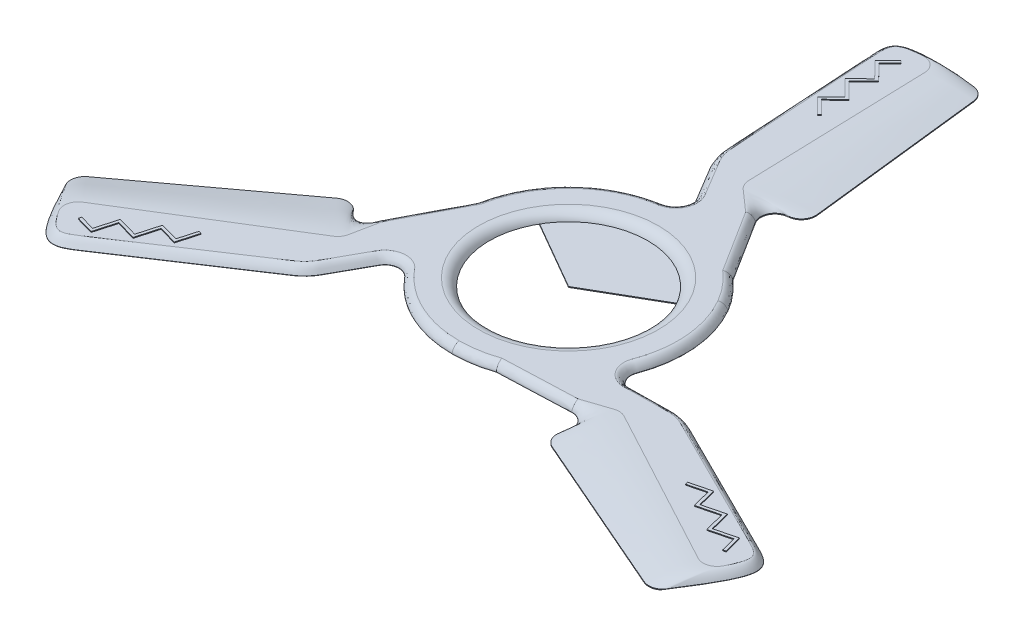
SolidWorks part; units mm, degrees
ref_plane "Front Plane" through (0, 0, 0) normal (0, 0, 1) x (1, 0, 0)
ref_plane "Top Plane" through (0, 0, 0) normal (0, 1, 0) x (1, 0, 0)
ref_plane "Right Plane" through (0, 0, 0) normal (1, 0, 0) x (0, 0, -1)
sketch "Sketch1" plane through (0, 0, 0) normal (0, 1, 0) x (1, 0, 0)
  line L0 (0, 133.3333) -> (-115.4701, -66.6667) construction
  line L1 (-115.4701, -66.6667) -> (115.4701, -66.6667) construction
  line L2 (115.4701, -66.6667) -> (0, 133.3333) construction
  line L3 (0, 133.3333) -> (0, 0) construction
  line L4 (14.8113, 128.356) -> (21.9143, 65.9427)
  line L5 (17.6439, 60.4262) -> (16.8663, 60.3167)
  line L6 (13.3352, 52.6977) -> (26.9924, 31.0503)
  line L7 (58.3991, -20.9341) -> (43.294, -21.1771)
  line L8 (-11.0701, 61.0421) -> (-3.3071, 48.0823)
  line L9 (-16.5142, 122.1729) -> (-13.1737, 67.8298)
  line L10 (114.062, -46.7847) -> (65.3292, -22.5061)
  line L11 (103.7539, -77.005) -> (46.1509, -51.9497)
  line L12 (43.5087, -45.4932) -> (43.8026, -44.765)
  line L13 (38.9699, -37.8974) -> (13.3942, -38.9012)
  line L14 (-47.329, -40.108) -> (-39.9869, -26.9052)
  line L15 (-97.5477, -75.3882) -> (-52.1554, -45.3237)
  line L16 (-118.5653, -51.351) -> (-68.0652, -13.993)
  line L17 (-61.1526, -14.933) -> (-60.6689, -15.5517)
  line L18 (-52.3051, -14.8003) -> (-40.3865, 7.8509)
  line L19 (-118.3722, -51.2083) -> (-71.4773, -16.5172)
  line L20 (-63.96, -11.3423) -> (-54.6343, -23.2701)
  line L21 (-56.1731, -22.1514) -> (-42.7971, 3.2696)
  line L22 (-53.1056, -50.4957) -> (-38.0894, -23.4931)
  line L23 (-96.7038, -74.8293) -> (-51.4545, -44.8594)
  line L24 (70.2834, -20.743) -> (39.3903, -21.2399)
  line L25 (113.156, -46.3334) -> (64.5766, -22.1312)
  line L26 (41.8027, -49.7198) -> (47.4696, -35.6796)
  line L27 (103.5338, -76.9092) -> (50.043, -53.6426)
  line L28 (47.2702, -37.5717) -> (18.567, -38.6982)
  line L29 (0, 0) -> (51.9615, 30) construction
  line L30 (0, 0) -> (-171.6742, 99.1162) construction
  circle A0 centre (0, 0) radius 133.3333 construction
  circle A1 centre (0, 0) radius 21.1426
  arc A2 (-6.7733, 40.5812) -> (-40.3865, 7.8509) centre (0, 0) ccw
  arc A4 (14.8113, 128.356) -> (10.0917, 132.7845) centre (9.8434, 127.7907) ccw
  arc A5 (65.3292, -22.5061) -> (58.3991, -20.9341) centre (58.6403, -35.9322) ccw
  arc A6 (103.7539, -77.005) -> (109.9489, -75.132) centre (105.7483, -72.42) ccw
  arc A7 (-13.1737, 67.8298) -> (-11.0701, 61.0421) centre (1.798, 68.7501) ccw
  arc A8 (21.9143, 65.9427) -> (17.6439, 60.4262) centre (16.9463, 65.3773) cw
  arc A9 (16.8663, 60.3167) -> (13.3352, 52.6977) centre (17.5639, 55.3656) ccw
  arc A10 (-118.5653, -51.351) -> (-120.0406, -57.6525) centre (-115.5917, -55.3707) ccw
  arc A11 (103.7539, -77.005) -> (109.9489, -75.132) centre (105.7483, -72.42) ccw
  arc A12 (46.1509, -51.9497) -> (43.5087, -45.4932) centre (48.1453, -47.3646) cw
  arc A13 (43.8026, -44.765) -> (38.9699, -37.8974) centre (39.166, -42.8936) ccw
  arc A14 (-52.1554, -45.3237) -> (-47.329, -40.108) centre (-60.4383, -32.8179) ccw
  arc A15 (-118.5653, -51.351) -> (-120.0406, -57.6525) centre (-115.5917, -55.3707) ccw
  arc A16 (-68.0652, -13.993) -> (-61.1526, -14.933) centre (-65.0916, -18.0127) cw
  arc A17 (-60.6689, -15.5517) -> (-52.3051, -14.8003) centre (-56.7299, -12.472) ccw
  circle A18 centre (0, 0) radius 41.1426 construction
  arc A19 (-31.7577, -26.1565) -> (13.3942, -38.9012) centre (0, 0) ccw
  arc A20 (38.531, -14.4247) -> (26.9924, 31.0503) centre (0, 0) ccw
  arc A21 (43.294, -21.1771) -> (38.531, -14.4247) centre (43.2136, -16.1777) cw
  arc A22 (-39.9869, -26.9052) -> (-31.7577, -26.1565) centre (-35.6171, -29.3352) cw
  arc A23 (-3.3071, 48.0823) -> (-6.7733, 40.5812) centre (-7.5965, 45.513) cw
  spline S0 degree 3 poles (10.0917, 132.7845) (-2.5557, 133.4135) (-16.6916, 133.1425) (-16.756, 126.1067) (-16.5142, 122.1729) knots 0.057289 0.057289 0.057289 0.057289 0.528644 1 1 1 1
  spline S1 degree 3 poles (109.9489, -75.132) (116.8173, -64.4934) (123.7868, -51.8838) (117.3172, -49.0066) (114.062, -46.7847) knots 0.057289 0.057289 0.057289 0.057289 0.528644 1 1 1 1
  spline S2 degree 3 poles (-120.0406, -57.6525) (-114.2616, -68.9201) (-106.8261, -81.2606) (-101.0995, -77.0964) (-97.5477, -75.3882) knots 0.057289 0.057289 0.057289 0.057289 0.528644 1 1 1 1
  point P43 (0, 0)
  point P87 (0, 0)
  dimension "D3" = 5
  dimension "D5" = 15
  dimension "D6" = 5
  dimension "D8" = 5
  dimension "D1" = 200
  dimension "D9" = 120
  dimension "D10" = 60
  dimension "D2" = 20
  dimension "D4" = 3
  dimension "D7" = 3
sketch "Sketch2" plane through (0, 0, 0) normal (0, 1, 0) x (1, 0, 0)
  line L30 (0.1519, 125.6874) -> (2.1157, 61.5073)
  line L31 (3.8041, 57.9121) -> (11.2208, 51.3637)
  line L32 (108.7753, -62.9767) -> (52.2091, -32.5859)
  line L33 (48.2513, -32.2505) -> (38.8719, -35.3993)
  line L34 (-108.9271, -62.7138) -> (-54.3247, -28.9214)
  line L35 (-52.0554, -25.6616) -> (-50.0927, -15.9644)
  line L45 (-14.0189, 122.3263) -> (-10.6784, 67.9832)
  line L46 (-8.9254, 62.3268) -> (-1.1624, 49.3669)
  line L47 (-38, 7.0178) -> (-50.0927, -15.9644)
  line L48 (-62.6384, -17.0915) -> (-63.1221, -16.4729)
  line L49 (-66.5784, -16.0029) -> (-117.0785, -53.3609)
  line L50 (-98.7878, -73.2109) -> (-53.5359, -43.2394)
  line L51 (-49.5139, -38.893) -> (-42.1718, -25.6902)
  line L52 (12.9224, -36.4178) -> (38.8719, -35.3993)
  line L53 (46.1209, -45.7007) -> (45.827, -46.4289)
  line L54 (47.1481, -49.6571) -> (104.7511, -74.7125)
  line L55 (112.7964, -48.9473) -> (64.2144, -24.7438)
  line L56 (58.4393, -23.4338) -> (43.3342, -23.6768)
  line L57 (25.0776, 29.4) -> (11.2208, 51.3637)
  line L58 (16.5175, 62.7922) -> (17.2951, 62.9018)
  line L59 (19.4303, 65.66) -> (12.3274, 128.0734)
  line L60 (-14.0189, 122.3263) -> (-10.6784, 67.9832)
  line L61 (-8.9254, 62.3268) -> (-1.1624, 49.3669)
  line L62 (-38, 7.0178) -> (-50.0927, -15.9644)
  line L65 (-98.7878, -73.2109) -> (-53.5359, -43.2394)
  line L66 (-49.5139, -38.893) -> (-42.1718, -25.6902)
  line L67 (12.9224, -36.4178) -> (38.8719, -35.3993)
  line L70 (112.7964, -48.9473) -> (64.2144, -24.7438)
  line L71 (58.4393, -23.4338) -> (43.3342, -23.6768)
  line L72 (25.0776, 29.4) -> (11.2208, 51.3637)
  arc A36 (2.1157, 61.5073) -> (3.8041, 57.9121) centre (7.1134, 61.6602) ccw
  arc A37 (52.2091, -32.5859) -> (48.2513, -32.2505) centre (49.8427, -36.9905) ccw
  arc A38 (-54.3247, -28.9214) -> (-52.0554, -25.6616) centre (-56.956, -24.6698) ccw
  arc A39 (-108.9271, -62.7138) -> (-110.49, -69.6873) centre (-106.2958, -66.9654) ccw
  arc A40 (108.7753, -62.9767) -> (115.596, -60.8435) centre (111.1417, -58.5722) ccw
  arc A41 (0.1519, 125.6874) -> (-5.1125, 130.5274) centre (-4.8458, 125.5345) ccw
  arc A54 (-10.6784, 67.9832) -> (-8.9254, 62.3268) centre (1.798, 68.7501) ccw
  arc A55 (-6.3618, 38.1153) -> (-1.1624, 49.3669) centre (-7.5965, 45.513) ccw
  arc A56 (-6.3618, 38.1153) -> (-38, 7.0178) centre (0, 0) ccw
  arc A57 (-62.6384, -17.0915) -> (-50.0927, -15.9644) centre (-56.7299, -12.472) ccw
  arc A58 (-63.1221, -16.4729) -> (-66.5784, -16.0029) centre (-65.0916, -18.0127) ccw
  arc A59 (-117.0785, -53.3609) -> (-117.8161, -56.5116) centre (-115.5917, -55.3707) ccw
  arc A60 (-53.5359, -43.2394) -> (-49.5139, -38.893) centre (-60.4383, -32.8179) ccw
  arc A61 (-29.8279, -24.5671) -> (-42.1718, -25.6902) centre (-35.6171, -29.3352) ccw
  arc A62 (-29.8279, -24.5671) -> (12.9224, -36.4178) centre (0, 0) ccw
  arc A63 (46.1209, -45.7007) -> (38.8719, -35.3993) centre (39.166, -42.8936) ccw
  arc A64 (45.827, -46.4289) -> (47.1481, -49.6571) centre (48.1453, -47.3646) ccw
  arc A65 (104.7511, -74.7125) -> (107.8486, -73.776) centre (105.7483, -72.42) ccw
  arc A66 (64.2144, -24.7438) -> (58.4393, -23.4338) centre (58.6403, -35.9322) ccw
  arc A67 (36.1897, -13.5482) -> (43.3342, -23.6768) centre (43.2136, -16.1777) ccw
  arc A68 (36.1897, -13.5482) -> (25.0776, 29.4) centre (0, 0) ccw
  arc A69 (16.5175, 62.7922) -> (11.2208, 51.3637) centre (17.5639, 55.3656) ccw
  arc A70 (17.2951, 62.9018) -> (19.4303, 65.66) centre (16.9463, 65.3773) ccw
  arc A71 (12.3274, 128.0734) -> (9.9676, 130.2876) centre (9.8434, 127.7907) ccw
  arc A72 (-10.6784, 67.9832) -> (-8.9254, 62.3268) centre (1.798, 68.7501) ccw
  arc A73 (-6.3618, 38.1153) -> (-1.1624, 49.3669) centre (-7.5965, 45.513) ccw
  arc A74 (-6.3618, 38.1153) -> (-38, 7.0178) centre (0, 0) ccw
  arc A78 (-53.5359, -43.2394) -> (-49.5139, -38.893) centre (-60.4383, -32.8179) ccw
  arc A79 (-29.8279, -24.5671) -> (-42.1718, -25.6902) centre (-35.6171, -29.3352) ccw
  arc A80 (-29.8279, -24.5671) -> (12.9224, -36.4178) centre (0, 0) ccw
  arc A84 (64.2144, -24.7438) -> (58.4393, -23.4338) centre (58.6403, -35.9322) ccw
  arc A85 (36.1897, -13.5482) -> (43.3342, -23.6768) centre (43.2136, -16.1777) ccw
  arc A86 (36.1897, -13.5482) -> (25.0776, 29.4) centre (0, 0) ccw
  spline S9 degree 3 poles (-1995.2262, -721.2333) (-142.2395, 160.3019) (-164.5779, 28.9927) (-113.7422, -64.2099) (-113.1359, -65.2966) (-111.8871, -67.4502) (-111.2454, -68.517) (-110.2339, -70.0846) (-109.8884, -70.6016) (-109.1722, -71.6193) (-108.8011, -72.1208) (-108.0211, -73.092) (-107.6113, -73.5643) (-106.9479, -74.2195) (-106.7189, -74.4286) (-106.356, -74.7197) (-106.2318, -74.8129) (-105.9742, -74.9886) (-105.8399, -75.0714) (-105.5641, -75.2181) (-105.4226, -75.2822) (-105.1296, -75.3864) (-104.9764, -75.4265) (-104.5117, -75.5) (-104.2017, -75.4867) (-103.5814, -75.3851) (-103.2834, -75.3005) (-102.6985, -75.1005) (-102.4119, -74.9843) (-101.561, -74.6109) (-101.0057, -74.3301) (-73.2187, -60.1882) (-49.0324, -40.2446) (875.9367, -1818.7216) knots -10.290782 -10.290782 -10.290782 -10.290782 0.25 0.25 0.375 0.375 0.5 0.5 0.5625 0.5625 0.625 0.625 0.6875 0.6875 0.71875 0.71875 0.734375 0.734375 0.75 0.75 0.765625 0.765625 0.78125 0.78125 0.8125 0.8125 0.84375 0.84375 0.875 0.875 0.9375 0.9375 4.012603 4.012603 4.012603 4.012603 only from (-117.8161, -56.5116) to (-98.7878, -73.2109)
  spline S10 degree 3 poles (1622.2194, -1367.3) (-67.7058, -203.334) (57.1805, -157.025) (112.4785, -66.3987) (113.1165, -65.3303) (114.3572, -63.1719) (114.9602, -62.0828) (115.812, -60.4231) (116.087, -59.8653) (116.6103, -58.7362) (116.859, -58.1641) (117.31, -57.003) (117.5142, -56.412) (117.7499, -55.5099) (117.8165, -55.207) (117.8872, -54.7472) (117.9058, -54.593) (117.9291, -54.2821) (117.9337, -54.1243) (117.9228, -53.8122) (117.9076, -53.6575) (117.8513, -53.3517) (117.8095, -53.199) (117.6408, -52.7598) (117.4742, -52.4979) (117.0761, -52.0116) (116.8538, -51.7958) (116.3882, -51.3892) (116.1442, -51.1992) (115.3954, -50.649) (114.8746, -50.3084) (88.7339, -33.3152) (59.369, -22.341) (1137.0907, 1667.9442) knots -10.290782 -10.290782 -10.290782 -10.290782 0.25 0.25 0.375 0.375 0.5 0.5 0.5625 0.5625 0.625 0.625 0.6875 0.6875 0.71875 0.71875 0.734375 0.734375 0.75 0.75 0.765625 0.765625 0.78125 0.78125 0.8125 0.8125 0.84375 0.84375 0.875 0.875 0.9375 0.9375 4.012603 4.012603 4.012603 4.012603 only from (107.8486, -73.776) to (112.7964, -48.9473)
  spline S11 degree 3 poles (370.7154, 2089.1164) (208.5289, 43.7019) (106.6812, 128.0468) (1.273, 130.6086) (0.0302, 130.6269) (-2.4567, 130.6216) (-3.7001, 130.5988) (-5.5612, 130.5051) (-6.1811, 130.4637) (-7.419, 130.3508) (-8.0382, 130.2793) (-9.2675, 130.0878) (-9.8801, 129.9684) (-10.7796, 129.723) (-11.0753, 129.6303) (-11.654, 129.4115) (-11.9372, 129.2859) (-12.4816, 128.9766) (-12.7373, 128.7953) (-13.0722, 128.4709) (-13.177, 128.3525) (-13.3647, 128.1011) (-13.447, 127.9693) (-13.6644, 127.5583) (-13.7711, 127.2602) (-13.929, 126.6583) (-13.9815, 126.3537) (-14.0931, 125.4337) (-14.107, 124.8105) (-13.6734, 93.7167) (44.2859, 65.0814) (-2007.3807, -30.9112) knots -10.229273 -10.229273 -10.229273 -10.229273 0.25 0.25 0.375 0.375 0.5 0.5 0.5625 0.5625 0.625 0.625 0.6875 0.6875 0.71875 0.71875 0.75 0.75 0.78125 0.78125 0.796875 0.796875 0.8125 0.8125 0.84375 0.84375 0.875 0.875 0.9375 0.9375 4.002014 4.002014 4.002014 4.002014 only from (9.9676, 130.2876) to (-14.0189, 122.3263)
  spline S12 degree 3 poles (-110.49, -69.6873) (-110.1786, -70.1672) (-109.8598, -70.6423) (-109.1722, -71.6193) (-108.8011, -72.1208) (-108.0211, -73.092) (-107.6113, -73.5643) (-106.9479, -74.2195) (-106.7189, -74.4286) (-106.356, -74.7197) (-106.2318, -74.8129) (-105.9742, -74.9886) (-105.8399, -75.0714) (-105.5641, -75.2181) (-105.4226, -75.2822) (-105.1296, -75.3864) (-104.9764, -75.4265) (-104.5117, -75.5) (-104.2017, -75.4867) (-103.5814, -75.3851) (-103.2834, -75.3005) (-102.6985, -75.1005) (-102.4119, -74.9843) (-101.561, -74.6109) (-101.0057, -74.3301) (-99.8986, -73.7667) (-99.3464, -73.4825) (-98.7878, -73.2109) knots 0.505 0.505 0.505 0.505 0.5625 0.5625 0.625 0.625 0.6875 0.6875 0.71875 0.71875 0.734375 0.734375 0.75 0.75 0.765625 0.765625 0.78125 0.78125 0.8125 0.8125 0.84375 0.84375 0.875 0.875 0.9375 0.9375 1 1 1 1
  spline S13 degree 3 poles (115.596, -60.8435) (115.8559, -60.3338) (116.1079, -59.8202) (116.6103, -58.7362) (116.859, -58.1641) (117.31, -57.003) (117.5142, -56.412) (117.7499, -55.5099) (117.8165, -55.207) (117.8872, -54.7472) (117.9058, -54.593) (117.9291, -54.2821) (117.9337, -54.1243) (117.9228, -53.8122) (117.9076, -53.6575) (117.8513, -53.3517) (117.8095, -53.199) (117.6408, -52.7598) (117.4742, -52.4979) (117.0761, -52.0116) (116.8538, -51.7958) (116.3882, -51.3892) (116.1442, -51.1992) (115.3954, -50.649) (114.8746, -50.3084) (113.8332, -49.6314) (113.3109, -49.2953) (112.7964, -48.9473) knots 0.505 0.505 0.505 0.505 0.5625 0.5625 0.625 0.625 0.6875 0.6875 0.71875 0.71875 0.734375 0.734375 0.75 0.75 0.765625 0.765625 0.78125 0.78125 0.8125 0.8125 0.84375 0.84375 0.875 0.875 0.9375 0.9375 1 1 1 1
  spline S14 degree 3 poles (-5.1125, 130.5274) (-5.6756, 130.4973) (-6.2382, 130.4585) (-7.419, 130.3508) (-8.0382, 130.2793) (-9.2675, 130.0878) (-9.8801, 129.9684) (-10.7796, 129.723) (-11.0753, 129.6303) (-11.654, 129.4115) (-11.9372, 129.2859) (-12.4816, 128.9766) (-12.7373, 128.7953) (-13.0722, 128.4709) (-13.177, 128.3525) (-13.3647, 128.1011) (-13.447, 127.9693) (-13.6644, 127.5583) (-13.7711, 127.2602) (-13.929, 126.6583) (-13.9815, 126.3537) (-14.0931, 125.4337) (-14.107, 124.8105) (-14.0897, 123.5675) (-14.0571, 122.9468) (-14.0189, 122.3263) knots 0.505765 0.505765 0.505765 0.505765 0.5625 0.5625 0.625 0.625 0.6875 0.6875 0.71875 0.71875 0.75 0.75 0.78125 0.78125 0.796875 0.796875 0.8125 0.8125 0.84375 0.84375 0.875 0.875 0.9375 0.9375 1 1 1 1
  point P12 (0, 0)
  dimension "D3" = 5
  dimension "D1" = 2.5
  dimension "D2" = 3
ref_plane "Plane1" through (0, 3, 0) normal (0, 1, 0) x (1, 0, 0)
sketch "Sketch3" plane through (0, 3, 0) normal (0, 1, 0) x (1, 0, 0)
  line L0 (-14.0189, 122.3263) -> (-10.6784, 67.9832) construction
  line L1 (-8.9254, 62.3268) -> (-1.1624, 49.3669) construction
  line L2 (-38, 7.0178) -> (-50.0927, -15.9644) construction
  line L3 (-52.0554, -25.6616) -> (-50.0927, -15.9644) construction
  line L4 (-108.9271, -62.7138) -> (-54.3247, -28.9214) construction
  line L5 (-98.7878, -73.2109) -> (-53.5359, -43.2394) construction
  line L6 (-49.5139, -38.893) -> (-42.1718, -25.6902) construction
  line L7 (12.9224, -36.4178) -> (38.8719, -35.3993) construction
  line L8 (48.2513, -32.2505) -> (38.8719, -35.3993) construction
  line L9 (108.7753, -62.9767) -> (52.2091, -32.5859) construction
  line L10 (112.7964, -48.9473) -> (64.2144, -24.7438) construction
  line L11 (58.4393, -23.4338) -> (43.3342, -23.6768) construction
  line L12 (25.0776, 29.4) -> (11.2208, 51.3637) construction
  line L13 (3.8041, 57.9121) -> (11.2208, 51.3637) construction
  line L14 (0.1519, 125.6874) -> (2.1157, 61.5073) construction
  line L15 (-14.0189, 122.3263) -> (-10.6784, 67.9832)
  line L16 (-8.9254, 62.3268) -> (-1.1624, 49.3669)
  line L17 (-38, 7.0178) -> (-50.0927, -15.9644)
  line L18 (-52.0554, -25.6616) -> (-50.0927, -15.9644)
  line L19 (-108.9271, -62.7138) -> (-54.3247, -28.9214)
  line L20 (-98.7878, -73.2109) -> (-53.5359, -43.2394)
  line L21 (-49.5139, -38.893) -> (-42.1718, -25.6902)
  line L22 (12.9224, -36.4178) -> (38.8719, -35.3993)
  line L23 (48.2513, -32.2505) -> (38.8719, -35.3993)
  line L24 (108.7753, -62.9767) -> (52.2091, -32.5859)
  line L25 (112.7964, -48.9473) -> (64.2144, -24.7438)
  line L26 (58.4393, -23.4338) -> (43.3342, -23.6768)
  line L27 (25.0776, 29.4) -> (11.2208, 51.3637)
  line L28 (3.8041, 57.9121) -> (11.2208, 51.3637)
  line L29 (0.1519, 125.6874) -> (2.1157, 61.5073)
  arc A0 (-10.6784, 67.9832) -> (-8.9254, 62.3268) centre (1.798, 68.7501) ccw construction
  arc A1 (-6.3618, 38.1153) -> (-1.1624, 49.3669) centre (-7.5965, 45.513) ccw construction
  arc A2 (-6.3618, 38.1153) -> (-38, 7.0178) centre (0, 0) ccw construction
  arc A3 (-54.3247, -28.9214) -> (-52.0554, -25.6616) centre (-56.956, -24.6698) ccw construction
  arc A4 (-108.9271, -62.7138) -> (-110.49, -69.6873) centre (-106.2958, -66.9654) ccw construction
  arc A5 (-53.5359, -43.2394) -> (-49.5139, -38.893) centre (-60.4383, -32.8179) ccw construction
  arc A6 (-29.8279, -24.5671) -> (-42.1718, -25.6902) centre (-35.6171, -29.3352) ccw construction
  arc A7 (-29.8279, -24.5671) -> (12.9224, -36.4178) centre (0, 0) ccw construction
  arc A8 (52.2091, -32.5859) -> (48.2513, -32.2505) centre (49.8427, -36.9905) ccw construction
  arc A9 (108.7753, -62.9767) -> (115.596, -60.8435) centre (111.1417, -58.5722) ccw construction
  arc A10 (64.2144, -24.7438) -> (58.4393, -23.4338) centre (58.6403, -35.9322) ccw construction
  arc A11 (36.1897, -13.5482) -> (43.3342, -23.6768) centre (43.2136, -16.1777) ccw construction
  arc A12 (36.1897, -13.5482) -> (25.0776, 29.4) centre (0, 0) ccw construction
  arc A13 (2.1157, 61.5073) -> (3.8041, 57.9121) centre (7.1134, 61.6602) ccw construction
  arc A14 (0.1519, 125.6874) -> (-5.1125, 130.5274) centre (-4.8458, 125.5345) ccw construction
  arc A15 (-10.6784, 67.9832) -> (-8.9254, 62.3268) centre (1.798, 68.7501) ccw
  arc A16 (-6.3618, 38.1153) -> (-1.1624, 49.3669) centre (-7.5965, 45.513) ccw
  arc A17 (-6.3618, 38.1153) -> (-38, 7.0178) centre (0, 0) ccw
  arc A18 (-54.3247, -28.9214) -> (-52.0554, -25.6616) centre (-56.956, -24.6698) ccw
  arc A19 (-108.9271, -62.7138) -> (-110.49, -69.6873) centre (-106.2958, -66.9654) ccw
  arc A20 (-53.5359, -43.2394) -> (-49.5139, -38.893) centre (-60.4383, -32.8179) ccw
  arc A21 (-29.8279, -24.5671) -> (-42.1718, -25.6902) centre (-35.6171, -29.3352) ccw
  arc A22 (-29.8279, -24.5671) -> (12.9224, -36.4178) centre (0, 0) ccw
  arc A23 (52.2091, -32.5859) -> (48.2513, -32.2505) centre (49.8427, -36.9905) ccw
  arc A24 (108.7753, -62.9767) -> (115.596, -60.8435) centre (111.1417, -58.5722) ccw
  arc A25 (64.2144, -24.7438) -> (58.4393, -23.4338) centre (58.6403, -35.9322) ccw
  arc A26 (36.1897, -13.5482) -> (43.3342, -23.6768) centre (43.2136, -16.1777) ccw
  arc A27 (36.1897, -13.5482) -> (25.0776, 29.4) centre (0, 0) ccw
  arc A28 (2.1157, 61.5073) -> (3.8041, 57.9121) centre (7.1134, 61.6602) ccw
  arc A29 (0.1519, 125.6874) -> (-5.1125, 130.5274) centre (-4.8458, 125.5345) ccw
  spline S0 degree 3 poles (-1004.366, -517.9957) (-106.2352, 21.6093) (-131.3859, -40.0566) (-109.1722, -71.6193) (-108.8011, -72.1208) (-108.0211, -73.092) (-107.6113, -73.5643) (-106.9479, -74.2195) (-106.7189, -74.4286) (-106.356, -74.7197) (-106.2318, -74.8129) (-105.9742, -74.9886) (-105.8399, -75.0714) (-105.5641, -75.2181) (-105.4226, -75.2822) (-105.1296, -75.3864) (-104.9764, -75.4265) (-104.5117, -75.5) (-104.2017, -75.4867) (-103.5814, -75.3851) (-103.2834, -75.3005) (-102.6985, -75.1005) (-102.4119, -74.9843) (-101.561, -74.6109) (-101.0057, -74.3301) (-78.8248, -63.0414) (-59.1192, -48.1977) (411.3419, -933.2913) knots -3.251699 -3.251699 -3.251699 -3.251699 0.5625 0.5625 0.625 0.625 0.6875 0.6875 0.71875 0.71875 0.734375 0.734375 0.75 0.75 0.765625 0.765625 0.78125 0.78125 0.8125 0.8125 0.84375 0.84375 0.875 0.875 0.9375 0.9375 3.379582 3.379582 3.379582 3.379582 only from (-110.49, -69.6873) to (-98.7878, -73.2109) construction
  spline S1 degree 3 poles (950.7804, -610.8086) (34.4034, -102.807) (100.3829, -93.7552) (116.6103, -58.7362) (116.859, -58.1641) (117.31, -57.003) (117.5142, -56.412) (117.7499, -55.5099) (117.8165, -55.207) (117.8872, -54.7472) (117.9058, -54.593) (117.9291, -54.2821) (117.9337, -54.1243) (117.9228, -53.8122) (117.9076, -53.6575) (117.8513, -53.3517) (117.8095, -53.199) (117.6408, -52.7598) (117.4742, -52.4979) (117.0761, -52.0116) (116.8538, -51.7958) (116.3882, -51.3892) (116.1442, -51.1992) (115.3954, -50.649) (114.8746, -50.3084) (94.0079, -36.7436) (71.3, -27.0999) (602.583, 822.8782) knots -3.251699 -3.251699 -3.251699 -3.251699 0.5625 0.5625 0.625 0.625 0.6875 0.6875 0.71875 0.71875 0.734375 0.734375 0.75 0.75 0.765625 0.765625 0.78125 0.78125 0.8125 0.8125 0.84375 0.84375 0.875 0.875 0.9375 0.9375 3.379582 3.379582 3.379582 3.379582 only from (115.596, -60.8435) to (112.7964, -48.9473) construction
  spline S2 degree 3 poles (52.2288, 1128.8801) (71.9721, 80.712) (31.0266, 133.8585) (-7.419, 130.3508) (-8.0382, 130.2793) (-9.2675, 130.0878) (-9.8801, 129.9684) (-10.7796, 129.723) (-11.0753, 129.6303) (-11.654, 129.4115) (-11.9372, 129.2859) (-12.4816, 128.9766) (-12.7373, 128.7953) (-13.0722, 128.4709) (-13.177, 128.3525) (-13.3647, 128.1011) (-13.447, 127.9693) (-13.6644, 127.5583) (-13.7711, 127.2602) (-13.929, 126.6583) (-13.9815, 126.3537) (-14.0931, 125.4337) (-14.107, 124.8105) (-13.7588, 99.8389) (23.3192, 76.6617) (-1008.6761, 19.3506) knots -3.256912 -3.256912 -3.256912 -3.256912 0.5625 0.5625 0.625 0.625 0.6875 0.6875 0.71875 0.71875 0.75 0.75 0.78125 0.78125 0.796875 0.796875 0.8125 0.8125 0.84375 0.84375 0.875 0.875 0.9375 0.9375 3.386329 3.386329 3.386329 3.386329 only from (-5.1125, 130.5274) to (-14.0189, 122.3263) construction
  spline S3 degree 3 poles (-110.49, -69.6873) (-110.1786, -70.1672) (-109.8598, -70.6423) (-109.1722, -71.6193) (-108.8011, -72.1208) (-108.0211, -73.092) (-107.6113, -73.5643) (-106.9479, -74.2195) (-106.7189, -74.4286) (-106.356, -74.7197) (-106.2318, -74.8129) (-105.9742, -74.9886) (-105.8399, -75.0714) (-105.5641, -75.2181) (-105.4226, -75.2822) (-105.1296, -75.3864) (-104.9764, -75.4265) (-104.5117, -75.5) (-104.2017, -75.4867) (-103.5814, -75.3851) (-103.2834, -75.3005) (-102.6985, -75.1005) (-102.4119, -74.9843) (-101.561, -74.6109) (-101.0057, -74.3301) (-99.8986, -73.7667) (-99.3464, -73.4825) (-98.7878, -73.2109) knots 0.505 0.505 0.505 0.505 0.5625 0.5625 0.625 0.625 0.6875 0.6875 0.71875 0.71875 0.734375 0.734375 0.75 0.75 0.765625 0.765625 0.78125 0.78125 0.8125 0.8125 0.84375 0.84375 0.875 0.875 0.9375 0.9375 1 1 1 1
  spline S4 degree 3 poles (115.596, -60.8435) (115.8559, -60.3338) (116.1079, -59.8202) (116.6103, -58.7362) (116.859, -58.1641) (117.31, -57.003) (117.5142, -56.412) (117.7499, -55.5099) (117.8165, -55.207) (117.8872, -54.7472) (117.9058, -54.593) (117.9291, -54.2821) (117.9337, -54.1243) (117.9228, -53.8122) (117.9076, -53.6575) (117.8513, -53.3517) (117.8095, -53.199) (117.6408, -52.7598) (117.4742, -52.4979) (117.0761, -52.0116) (116.8538, -51.7958) (116.3882, -51.3892) (116.1442, -51.1992) (115.3954, -50.649) (114.8746, -50.3084) (113.8332, -49.6314) (113.3109, -49.2953) (112.7964, -48.9473) knots 0.505 0.505 0.505 0.505 0.5625 0.5625 0.625 0.625 0.6875 0.6875 0.71875 0.71875 0.734375 0.734375 0.75 0.75 0.765625 0.765625 0.78125 0.78125 0.8125 0.8125 0.84375 0.84375 0.875 0.875 0.9375 0.9375 1 1 1 1
  spline S5 degree 3 poles (-5.1125, 130.5274) (-5.6756, 130.4973) (-6.2382, 130.4585) (-7.419, 130.3508) (-8.0382, 130.2793) (-9.2675, 130.0878) (-9.8801, 129.9684) (-10.7796, 129.723) (-11.0753, 129.6303) (-11.654, 129.4115) (-11.9372, 129.2859) (-12.4816, 128.9766) (-12.7373, 128.7953) (-13.0722, 128.4709) (-13.177, 128.3525) (-13.3647, 128.1011) (-13.447, 127.9693) (-13.6644, 127.5583) (-13.7711, 127.2602) (-13.929, 126.6583) (-13.9815, 126.3537) (-14.0931, 125.4337) (-14.107, 124.8105) (-14.0897, 123.5675) (-14.0571, 122.9468) (-14.0189, 122.3263) knots 0.505765 0.505765 0.505765 0.505765 0.5625 0.5625 0.625 0.625 0.6875 0.6875 0.71875 0.71875 0.75 0.75 0.78125 0.78125 0.796875 0.796875 0.8125 0.8125 0.84375 0.84375 0.875 0.875 0.9375 0.9375 1 1 1 1
surface "Surface-Plane1" sketch "Sketch3"
surface "Surface-Plane2" sketch "Sketch1"
sketch "Sketch4" plane through (0, 0, 0) normal (0, 1, 0) x (1, 0, 0)
  line L15 (26.9924, 31.0503) -> (13.3352, 52.6977)
  line L16 (16.8663, 60.3167) -> (17.6439, 60.4262)
  line L17 (21.9143, 65.9427) -> (14.8113, 128.356)
  line L18 (-16.5142, 122.1729) -> (-13.1737, 67.8298)
  line L19 (-11.0701, 61.0421) -> (-3.3071, 48.0823)
  line L20 (-40.3865, 7.8509) -> (-52.3051, -14.8003)
  line L21 (-60.6689, -15.5517) -> (-61.1526, -14.933)
  line L22 (-68.0652, -13.993) -> (-118.5653, -51.351)
  line L23 (-97.5477, -75.3882) -> (-52.1554, -45.3237)
  line L24 (-47.329, -40.108) -> (-39.9869, -26.9052)
  line L25 (13.3942, -38.9012) -> (38.9699, -37.8974)
  line L26 (43.8026, -44.765) -> (43.5087, -45.4932)
  line L27 (46.1509, -51.9497) -> (103.7539, -77.005)
  line L28 (114.062, -46.7847) -> (65.3292, -22.5061)
  line L29 (58.3991, -20.9341) -> (43.294, -21.1771)
  line L30 (26.9924, 31.0503) -> (13.3352, 52.6977)
  line L31 (16.8663, 60.3167) -> (17.6439, 60.4262)
  line L32 (21.9143, 65.9427) -> (14.8113, 128.356)
  line L33 (-16.5142, 122.1729) -> (-13.1737, 67.8298)
  line L34 (-11.0701, 61.0421) -> (-3.3071, 48.0823)
  line L35 (-40.3865, 7.8509) -> (-52.3051, -14.8003)
  line L36 (-60.6689, -15.5517) -> (-61.1526, -14.933)
  line L37 (-68.0652, -13.993) -> (-118.5653, -51.351)
  line L38 (-97.5477, -75.3882) -> (-52.1554, -45.3237)
  line L39 (-47.329, -40.108) -> (-39.9869, -26.9052)
  line L40 (13.3942, -38.9012) -> (38.9699, -37.8974)
  line L41 (43.8026, -44.765) -> (43.5087, -45.4932)
  line L42 (46.1509, -51.9497) -> (103.7539, -77.005)
  line L43 (114.062, -46.7847) -> (65.3292, -22.5061)
  line L44 (58.3991, -20.9341) -> (43.294, -21.1771)
  arc A18 (38.531, -14.4247) -> (43.294, -21.1771) centre (43.2136, -16.1777) ccw
  arc A19 (38.531, -14.4247) -> (26.9924, 31.0503) centre (0, 0) ccw
  arc A20 (16.8663, 60.3167) -> (13.3352, 52.6977) centre (17.5639, 55.3656) ccw
  arc A21 (17.6439, 60.4262) -> (21.9143, 65.9427) centre (16.9463, 65.3773) ccw
  arc A22 (14.8113, 128.356) -> (10.0917, 132.7845) centre (9.8434, 127.7907) ccw
  arc A23 (-13.1737, 67.8298) -> (-11.0701, 61.0421) centre (1.798, 68.7501) ccw
  arc A24 (-6.7733, 40.5812) -> (-3.3071, 48.0823) centre (-7.5965, 45.513) ccw
  arc A25 (-6.7733, 40.5812) -> (-40.3865, 7.8509) centre (0, 0) ccw
  arc A26 (-60.6689, -15.5517) -> (-52.3051, -14.8003) centre (-56.7299, -12.472) ccw
  arc A27 (-61.1526, -14.933) -> (-68.0652, -13.993) centre (-65.0916, -18.0127) ccw
  arc A28 (-118.5653, -51.351) -> (-120.0406, -57.6525) centre (-115.5917, -55.3707) ccw
  arc A29 (-52.1554, -45.3237) -> (-47.329, -40.108) centre (-60.4383, -32.8179) ccw
  arc A30 (-31.7577, -26.1565) -> (-39.9869, -26.9052) centre (-35.6171, -29.3352) ccw
  arc A31 (-31.7577, -26.1565) -> (13.3942, -38.9012) centre (0, 0) ccw
  arc A32 (43.8026, -44.765) -> (38.9699, -37.8974) centre (39.166, -42.8936) ccw
  arc A33 (43.5087, -45.4932) -> (46.1509, -51.9497) centre (48.1453, -47.3646) ccw
  arc A34 (103.7539, -77.005) -> (109.9489, -75.132) centre (105.7483, -72.42) ccw
  arc A35 (65.3292, -22.5061) -> (58.3991, -20.9341) centre (58.6403, -35.9322) ccw
  arc A36 (38.531, -14.4247) -> (43.294, -21.1771) centre (43.2136, -16.1777) ccw
  arc A37 (38.531, -14.4247) -> (26.9924, 31.0503) centre (0, 0) ccw
  arc A38 (16.8663, 60.3167) -> (13.3352, 52.6977) centre (17.5639, 55.3656) ccw
  arc A39 (17.6439, 60.4262) -> (21.9143, 65.9427) centre (16.9463, 65.3773) ccw
  arc A40 (14.8113, 128.356) -> (10.0917, 132.7845) centre (9.8434, 127.7907) ccw
  arc A41 (-13.1737, 67.8298) -> (-11.0701, 61.0421) centre (1.798, 68.7501) ccw
  arc A42 (-6.7733, 40.5812) -> (-3.3071, 48.0823) centre (-7.5965, 45.513) ccw
  arc A43 (-6.7733, 40.5812) -> (-40.3865, 7.8509) centre (0, 0) ccw
  arc A44 (-60.6689, -15.5517) -> (-52.3051, -14.8003) centre (-56.7299, -12.472) ccw
  arc A45 (-61.1526, -14.933) -> (-68.0652, -13.993) centre (-65.0916, -18.0127) ccw
  arc A46 (-118.5653, -51.351) -> (-120.0406, -57.6525) centre (-115.5917, -55.3707) ccw
  arc A47 (-52.1554, -45.3237) -> (-47.329, -40.108) centre (-60.4383, -32.8179) ccw
  arc A48 (-31.7577, -26.1565) -> (-39.9869, -26.9052) centre (-35.6171, -29.3352) ccw
  arc A49 (-31.7577, -26.1565) -> (13.3942, -38.9012) centre (0, 0) ccw
  arc A50 (43.8026, -44.765) -> (38.9699, -37.8974) centre (39.166, -42.8936) ccw
  arc A51 (43.5087, -45.4932) -> (46.1509, -51.9497) centre (48.1453, -47.3646) ccw
  arc A52 (103.7539, -77.005) -> (109.9489, -75.132) centre (105.7483, -72.42) ccw
  arc A53 (65.3292, -22.5061) -> (58.3991, -20.9341) centre (58.6403, -35.9322) ccw
  spline S3 degree 3 poles (1994.8516, 359.8592) (289.5706, 44.7193) (-294.7165, 262.7249) (235.4639, -55.0503) (-1926.9727, 709.19) knots -3.394168 -3.394168 -3.394168 -3.394168 0.528644 4.995495 4.995495 4.995495 4.995495 only from (10.0917, 132.7845) to (-16.5142, 122.1729)
  spline S4 degree 3 poles (-1339.6812, 1523.5224) (-195.9226, 265.7443) (-76.6606, -377.9333) (-82.1534, 183.1907) (558.7411, -1963.0927) knots -3.540984 -3.540984 -3.540984 -3.540984 0.528644 4.513398 4.513398 4.513398 4.513398 only from (-120.0406, -57.6525) to (-97.5477, -75.3882)
  spline S5 degree 3 poles (-649.5685, -1921.9591) (-132.18, -302.5461) (365.6301, 122.5767) (-117.5711, -162.7423) (1420.7176, 1465.4304) knots -3.540984 -3.540984 -3.540984 -3.540984 0.528644 4.513398 4.513398 4.513398 4.513398 only from (109.9489, -75.132) to (114.062, -46.7847)
  spline S6 degree 3 poles (10.0917, 132.7845) (-2.5557, 133.4135) (-16.6916, 133.1425) (-16.756, 126.1067) (-16.5142, 122.1729) knots 0.057289 0.057289 0.057289 0.057289 0.528644 1 1 1 1
  spline S7 degree 3 poles (-120.0406, -57.6525) (-114.2616, -68.9201) (-106.8261, -81.2606) (-101.0995, -77.0964) (-97.5477, -75.3882) knots 0.057289 0.057289 0.057289 0.057289 0.528644 1 1 1 1
  spline S8 degree 3 poles (109.9489, -75.132) (116.8173, -64.4934) (123.7868, -51.8838) (117.3172, -49.0066) (114.062, -46.7847) knots 0.057289 0.057289 0.057289 0.057289 0.528644 1 1 1 1
  dimension "D1" = 0
extrude "Boss-Extrude1" add sketch "Sketch4" along normal blind 0.3
sketch "Sketch5" plane through (0, 0.3, 0) normal (0, 1, 0) x (1, 0, 0)
  line L15 (26.9924, 31.0503) -> (13.3352, 52.6977)
  line L16 (16.8663, 60.3167) -> (17.6439, 60.4262)
  line L17 (21.9143, 65.9427) -> (14.8113, 128.356)
  line L18 (-16.5142, 122.1729) -> (-13.1737, 67.8298)
  line L19 (-11.0701, 61.0421) -> (-3.3071, 48.0823)
  line L20 (-40.3865, 7.8509) -> (-52.3051, -14.8003)
  line L21 (-60.6689, -15.5517) -> (-61.1526, -14.933)
  line L22 (-68.0652, -13.993) -> (-118.5653, -51.351)
  line L23 (-97.5477, -75.3882) -> (-52.1554, -45.3237)
  line L24 (-47.329, -40.108) -> (-39.9869, -26.9052)
  line L25 (13.3942, -38.9012) -> (38.9699, -37.8974)
  line L26 (43.8026, -44.765) -> (43.5087, -45.4932)
  line L27 (46.1509, -51.9497) -> (103.7539, -77.005)
  line L28 (114.062, -46.7847) -> (65.3292, -22.5061)
  line L29 (58.3991, -20.9341) -> (43.294, -21.1771)
  line L30 (26.9924, 31.0503) -> (13.3352, 52.6977)
  line L31 (16.8663, 60.3167) -> (17.6439, 60.4262)
  line L32 (21.9143, 65.9427) -> (14.8113, 128.356)
  line L33 (-16.5142, 122.1729) -> (-13.1737, 67.8298)
  line L34 (-11.0701, 61.0421) -> (-3.3071, 48.0823)
  line L35 (-40.3865, 7.8509) -> (-52.3051, -14.8003)
  line L36 (-60.6689, -15.5517) -> (-61.1526, -14.933)
  line L37 (-68.0652, -13.993) -> (-118.5653, -51.351)
  line L38 (-97.5477, -75.3882) -> (-52.1554, -45.3237)
  line L39 (-47.329, -40.108) -> (-39.9869, -26.9052)
  line L40 (13.3942, -38.9012) -> (38.9699, -37.8974)
  line L41 (43.8026, -44.765) -> (43.5087, -45.4932)
  line L42 (46.1509, -51.9497) -> (103.7539, -77.005)
  line L43 (114.062, -46.7847) -> (65.3292, -22.5061)
  line L44 (58.3991, -20.9341) -> (43.294, -21.1771)
  arc A18 (38.531, -14.4247) -> (26.9924, 31.0503) centre (0, 0) ccw
  arc A19 (16.8663, 60.3167) -> (13.3352, 52.6977) centre (17.5639, 55.3656) ccw
  arc A20 (17.6439, 60.4262) -> (21.9143, 65.9427) centre (16.9463, 65.3773) ccw
  arc A21 (14.8113, 128.356) -> (10.0917, 132.7845) centre (9.8434, 127.7907) ccw
  arc A22 (-13.1737, 67.8298) -> (-11.0701, 61.0421) centre (1.798, 68.7501) ccw
  arc A23 (-6.7733, 40.5812) -> (-3.3071, 48.0823) centre (-7.5965, 45.513) ccw
  arc A24 (-6.7733, 40.5812) -> (-40.3865, 7.8509) centre (0, 0) ccw
  arc A25 (-60.6689, -15.5517) -> (-52.3051, -14.8003) centre (-56.7299, -12.472) ccw
  arc A26 (-61.1526, -14.933) -> (-68.0652, -13.993) centre (-65.0916, -18.0127) ccw
  arc A27 (-118.5653, -51.351) -> (-120.0406, -57.6525) centre (-115.5917, -55.3707) ccw
  arc A28 (-52.1554, -45.3237) -> (-47.329, -40.108) centre (-60.4383, -32.8179) ccw
  arc A29 (-31.7577, -26.1565) -> (-39.9869, -26.9052) centre (-35.6171, -29.3352) ccw
  arc A30 (-31.7577, -26.1565) -> (13.3942, -38.9012) centre (0, 0) ccw
  arc A31 (43.8026, -44.765) -> (38.9699, -37.8974) centre (39.166, -42.8936) ccw
  arc A32 (43.5087, -45.4932) -> (46.1509, -51.9497) centre (48.1453, -47.3646) ccw
  arc A33 (103.7539, -77.005) -> (109.9489, -75.132) centre (105.7483, -72.42) ccw
  arc A34 (65.3292, -22.5061) -> (58.3991, -20.9341) centre (58.6403, -35.9322) ccw
  arc A35 (38.531, -14.4247) -> (43.294, -21.1771) centre (43.2136, -16.1777) ccw
  arc A36 (38.531, -14.4247) -> (26.9924, 31.0503) centre (0, 0) ccw
  arc A37 (16.8663, 60.3167) -> (13.3352, 52.6977) centre (17.5639, 55.3656) ccw
  arc A38 (17.6439, 60.4262) -> (21.9143, 65.9427) centre (16.9463, 65.3773) ccw
  arc A39 (14.8113, 128.356) -> (10.0917, 132.7845) centre (9.8434, 127.7907) ccw
  arc A40 (-13.1737, 67.8298) -> (-11.0701, 61.0421) centre (1.798, 68.7501) ccw
  arc A41 (-6.7733, 40.5812) -> (-3.3071, 48.0823) centre (-7.5965, 45.513) ccw
  arc A42 (-6.7733, 40.5812) -> (-40.3865, 7.8509) centre (0, 0) ccw
  arc A43 (-60.6689, -15.5517) -> (-52.3051, -14.8003) centre (-56.7299, -12.472) ccw
  arc A44 (-61.1526, -14.933) -> (-68.0652, -13.993) centre (-65.0916, -18.0127) ccw
  arc A45 (-118.5653, -51.351) -> (-120.0406, -57.6525) centre (-115.5917, -55.3707) ccw
  arc A46 (-52.1554, -45.3237) -> (-47.329, -40.108) centre (-60.4383, -32.8179) ccw
  arc A47 (-31.7577, -26.1565) -> (-39.9869, -26.9052) centre (-35.6171, -29.3352) ccw
  arc A48 (-31.7577, -26.1565) -> (13.3942, -38.9012) centre (0, 0) ccw
  arc A49 (43.8026, -44.765) -> (38.9699, -37.8974) centre (39.166, -42.8936) ccw
  arc A50 (43.5087, -45.4932) -> (46.1509, -51.9497) centre (48.1453, -47.3646) ccw
  arc A51 (103.7539, -77.005) -> (109.9489, -75.132) centre (105.7483, -72.42) ccw
  arc A52 (65.3292, -22.5061) -> (58.3991, -20.9341) centre (58.6403, -35.9322) ccw
  arc A53 (38.531, -14.4247) -> (43.294, -21.1771) centre (43.2136, -16.1777) ccw
  spline S3 degree 3 poles (1994.8516, 359.8592) (289.5706, 44.7193) (-294.7165, 262.7249) (235.4639, -55.0503) (-1926.9727, 709.19) knots -3.394168 -3.394168 -3.394168 -3.394168 0.528644 4.995495 4.995495 4.995495 4.995495 only from (10.0917, 132.7845) to (-16.5142, 122.1729)
  spline S4 degree 3 poles (-1339.6812, 1523.5224) (-195.9226, 265.7443) (-76.6606, -377.9333) (-82.1534, 183.1907) (558.7411, -1963.0927) knots -3.540984 -3.540984 -3.540984 -3.540984 0.528644 4.513398 4.513398 4.513398 4.513398 only from (-120.0406, -57.6525) to (-97.5477, -75.3882)
  spline S5 degree 3 poles (-649.5685, -1921.9591) (-132.18, -302.5461) (365.6301, 122.5767) (-117.5711, -162.7423) (1420.7176, 1465.4304) knots -3.540984 -3.540984 -3.540984 -3.540984 0.528644 4.513398 4.513398 4.513398 4.513398 only from (109.9489, -75.132) to (114.062, -46.7847)
  spline S6 degree 3 poles (10.0917, 132.7845) (-2.5557, 133.4135) (-16.6916, 133.1425) (-16.756, 126.1067) (-16.5142, 122.1729) knots 0.057289 0.057289 0.057289 0.057289 0.528644 1 1 1 1
  spline S7 degree 3 poles (-120.0406, -57.6525) (-114.2616, -68.9201) (-106.8261, -81.2606) (-101.0995, -77.0964) (-97.5477, -75.3882) knots 0.057289 0.057289 0.057289 0.057289 0.528644 1 1 1 1
  spline S8 degree 3 poles (109.9489, -75.132) (116.8173, -64.4934) (123.7868, -51.8838) (117.3172, -49.0066) (114.062, -46.7847) knots 0.057289 0.057289 0.057289 0.057289 0.528644 1 1 1 1
  dimension "D1" = 0
sketch "Sketch6" plane through (0, 3, 0) normal (0, 1, 0) x (1, 0, 0)
  line L15 (-14.0189, 122.3263) -> (-10.6784, 67.9832)
  line L16 (-8.9254, 62.3268) -> (-1.1624, 49.3669)
  line L17 (-38, 7.0178) -> (-50.0927, -15.9644)
  line L18 (-50.0927, -15.9644) -> (-52.0554, -25.6616)
  line L19 (-54.3247, -28.9214) -> (-108.9271, -62.7138)
  line L20 (-98.7878, -73.2109) -> (-53.5359, -43.2394)
  line L21 (-49.5139, -38.893) -> (-42.1718, -25.6902)
  line L22 (12.9224, -36.4178) -> (38.8719, -35.3993)
  line L23 (38.8719, -35.3993) -> (48.2513, -32.2505)
  line L24 (52.2091, -32.5859) -> (108.7753, -62.9767)
  line L25 (112.7964, -48.9473) -> (64.2144, -24.7438)
  line L26 (58.4393, -23.4338) -> (43.3342, -23.6768)
  line L27 (25.0776, 29.4) -> (11.2208, 51.3637)
  line L28 (11.2208, 51.3637) -> (3.8041, 57.9121)
  line L29 (2.1157, 61.5073) -> (0.1519, 125.6874)
  line L30 (-14.0189, 122.3263) -> (-10.6784, 67.9832)
  line L31 (-8.9254, 62.3268) -> (-1.1624, 49.3669)
  line L32 (-38, 7.0178) -> (-50.0927, -15.9644)
  line L33 (-50.0927, -15.9644) -> (-52.0554, -25.6616)
  line L34 (-54.3247, -28.9214) -> (-108.9271, -62.7138)
  line L35 (-98.7878, -73.2109) -> (-53.5359, -43.2394)
  line L36 (-49.5139, -38.893) -> (-42.1718, -25.6902)
  line L37 (12.9224, -36.4178) -> (38.8719, -35.3993)
  line L38 (38.8719, -35.3993) -> (48.2513, -32.2505)
  line L39 (52.2091, -32.5859) -> (108.7753, -62.9767)
  line L40 (112.7964, -48.9473) -> (64.2144, -24.7438)
  line L41 (58.4393, -23.4338) -> (43.3342, -23.6768)
  line L42 (25.0776, 29.4) -> (11.2208, 51.3637)
  line L43 (11.2208, 51.3637) -> (3.8041, 57.9121)
  line L44 (2.1157, 61.5073) -> (0.1519, 125.6874)
  arc A15 (-10.6784, 67.9832) -> (-8.9254, 62.3268) centre (1.798, 68.7501) ccw
  arc A16 (-6.3618, 38.1153) -> (-1.1624, 49.3669) centre (-7.5965, 45.513) ccw
  arc A17 (-6.3618, 38.1153) -> (-38, 7.0178) centre (0, 0) ccw
  arc A18 (-54.3247, -28.9214) -> (-52.0554, -25.6616) centre (-56.956, -24.6698) ccw
  arc A19 (-108.9271, -62.7138) -> (-110.49, -69.6873) centre (-106.2958, -66.9654) ccw
  arc A20 (-53.5359, -43.2394) -> (-49.5139, -38.893) centre (-60.4383, -32.8179) ccw
  arc A21 (-29.8279, -24.5671) -> (-42.1718, -25.6902) centre (-35.6171, -29.3352) ccw
  arc A22 (-29.8279, -24.5671) -> (12.9224, -36.4178) centre (0, 0) ccw
  arc A23 (52.2091, -32.5859) -> (48.2513, -32.2505) centre (49.8427, -36.9905) ccw
  arc A24 (108.7753, -62.9767) -> (115.596, -60.8435) centre (111.1417, -58.5722) ccw
  arc A25 (64.2144, -24.7438) -> (58.4393, -23.4338) centre (58.6403, -35.9322) ccw
  arc A26 (36.1897, -13.5482) -> (43.3342, -23.6768) centre (43.2136, -16.1777) ccw
  arc A27 (36.1897, -13.5482) -> (25.0776, 29.4) centre (0, 0) ccw
  arc A28 (2.1157, 61.5073) -> (3.8041, 57.9121) centre (7.1134, 61.6602) ccw
  arc A29 (0.1519, 125.6874) -> (-5.1125, 130.5274) centre (-4.8458, 125.5345) ccw
  arc A30 (-10.6784, 67.9832) -> (-8.9254, 62.3268) centre (1.798, 68.7501) ccw
  arc A31 (-6.3618, 38.1153) -> (-1.1624, 49.3669) centre (-7.5965, 45.513) ccw
  arc A32 (-6.3618, 38.1153) -> (-38, 7.0178) centre (0, 0) ccw
  arc A33 (-54.3247, -28.9214) -> (-52.0554, -25.6616) centre (-56.956, -24.6698) ccw
  arc A34 (-108.9271, -62.7138) -> (-110.49, -69.6873) centre (-106.2958, -66.9654) ccw
  arc A35 (-53.5359, -43.2394) -> (-49.5139, -38.893) centre (-60.4383, -32.8179) ccw
  arc A36 (-29.8279, -24.5671) -> (-42.1718, -25.6902) centre (-35.6171, -29.3352) ccw
  arc A37 (-29.8279, -24.5671) -> (12.9224, -36.4178) centre (0, 0) ccw
  arc A38 (52.2091, -32.5859) -> (48.2513, -32.2505) centre (49.8427, -36.9905) ccw
  arc A39 (108.7753, -62.9767) -> (115.596, -60.8435) centre (111.1417, -58.5722) ccw
  arc A40 (64.2144, -24.7438) -> (58.4393, -23.4338) centre (58.6403, -35.9322) ccw
  arc A41 (36.1897, -13.5482) -> (43.3342, -23.6768) centre (43.2136, -16.1777) ccw
  arc A42 (36.1897, -13.5482) -> (25.0776, 29.4) centre (0, 0) ccw
  arc A43 (2.1157, 61.5073) -> (3.8041, 57.9121) centre (7.1134, 61.6602) ccw
  arc A44 (0.1519, 125.6874) -> (-5.1125, 130.5274) centre (-4.8458, 125.5345) ccw
  spline S3 degree 3 poles (25.4043, 2128.4801) (92.4545, 50.9) (40.3992, 134.7136) (-7.419, 130.3508) (-8.0382, 130.2793) (-9.2675, 130.0878) (-9.8801, 129.9684) (-10.7796, 129.723) (-11.0753, 129.6303) (-11.654, 129.4115) (-11.9372, 129.2859) (-12.4816, 128.9766) (-12.7373, 128.7953) (-13.0722, 128.4709) (-13.177, 128.3525) (-13.3647, 128.1011) (-13.447, 127.9693) (-13.6644, 127.5583) (-13.7711, 127.2602) (-13.929, 126.6583) (-13.9815, 126.3537) (-14.0931, 125.4337) (-14.107, 124.8105) (-13.6734, 93.7168) (44.2858, 65.0815) (-2007.3753, -30.911) knots -4.203282 -4.203282 -4.203282 -4.203282 0.5625 0.5625 0.625 0.625 0.6875 0.6875 0.71875 0.71875 0.75 0.75 0.78125 0.78125 0.796875 0.796875 0.8125 0.8125 0.84375 0.84375 0.875 0.875 0.9375 0.9375 4.002012 4.002012 4.002012 4.002012 only from (-5.1125, 130.5274) to (-14.0189, 122.3263)
  spline S4 degree 3 poles (-1857.3479, -1039.804) (-90.876, 54.0659) (-136.8041, -32.358) (-109.1722, -71.6193) (-108.8011, -72.1208) (-108.0211, -73.092) (-107.6113, -73.5643) (-106.9479, -74.2195) (-106.7189, -74.4286) (-106.356, -74.7197) (-106.2318, -74.8129) (-105.9742, -74.9886) (-105.8399, -75.0714) (-105.5641, -75.2181) (-105.4226, -75.2822) (-105.1296, -75.3864) (-104.9764, -75.4265) (-104.5117, -75.5) (-104.2017, -75.4867) (-103.5814, -75.3851) (-103.2834, -75.3005) (-102.6985, -75.1005) (-102.4119, -74.9843) (-101.561, -74.6109) (-101.0057, -74.3301) (-73.2184, -60.1881) (-49.0318, -40.2441) (875.9672, -1818.7802) knots -4.197276 -4.197276 -4.197276 -4.197276 0.5625 0.5625 0.625 0.625 0.6875 0.6875 0.71875 0.71875 0.734375 0.734375 0.75 0.75 0.765625 0.765625 0.78125 0.78125 0.8125 0.8125 0.84375 0.84375 0.875 0.875 0.9375 0.9375 4.012636 4.012636 4.012636 4.012636 only from (-110.49, -69.6873) to (-98.7878, -73.2109)
  spline S5 degree 3 poles (1829.1707, -1088.6085) (-1.3844, -105.7338) (96.4249, -102.2968) (116.6103, -58.7362) (116.859, -58.1641) (117.31, -57.003) (117.5142, -56.412) (117.7499, -55.5099) (117.8165, -55.207) (117.8872, -54.7472) (117.9058, -54.593) (117.9291, -54.2821) (117.9337, -54.1243) (117.9228, -53.8122) (117.9076, -53.6575) (117.8513, -53.3517) (117.8095, -53.199) (117.6408, -52.7598) (117.4742, -52.4979) (117.0761, -52.0116) (116.8538, -51.7958) (116.3882, -51.3892) (116.1442, -51.1992) (115.3954, -50.649) (114.8746, -50.3084) (88.7336, -33.315) (59.3683, -22.3408) (1137.1262, 1667.9999) knots -4.197276 -4.197276 -4.197276 -4.197276 0.5625 0.5625 0.625 0.625 0.6875 0.6875 0.71875 0.71875 0.734375 0.734375 0.75 0.75 0.765625 0.765625 0.78125 0.78125 0.8125 0.8125 0.84375 0.84375 0.875 0.875 0.9375 0.9375 4.012636 4.012636 4.012636 4.012636 only from (115.596, -60.8435) to (112.7964, -48.9473)
  spline S6 degree 3 poles (-5.1125, 130.5274) (-5.6756, 130.4973) (-6.2382, 130.4585) (-7.419, 130.3508) (-8.0382, 130.2793) (-9.2675, 130.0878) (-9.8801, 129.9684) (-10.7796, 129.723) (-11.0753, 129.6303) (-11.654, 129.4115) (-11.9372, 129.2859) (-12.4816, 128.9766) (-12.7373, 128.7953) (-13.0722, 128.4709) (-13.177, 128.3525) (-13.3647, 128.1011) (-13.447, 127.9693) (-13.6644, 127.5583) (-13.7711, 127.2602) (-13.929, 126.6583) (-13.9815, 126.3537) (-14.0931, 125.4337) (-14.107, 124.8105) (-14.0897, 123.5675) (-14.0571, 122.9468) (-14.0189, 122.3263) knots 0.505765 0.505765 0.505765 0.505765 0.5625 0.5625 0.625 0.625 0.6875 0.6875 0.71875 0.71875 0.75 0.75 0.78125 0.78125 0.796875 0.796875 0.8125 0.8125 0.84375 0.84375 0.875 0.875 0.9375 0.9375 1 1 1 1
  spline S7 degree 3 poles (-110.49, -69.6873) (-110.1786, -70.1672) (-109.8598, -70.6423) (-109.1722, -71.6193) (-108.8011, -72.1208) (-108.0211, -73.092) (-107.6113, -73.5643) (-106.9479, -74.2195) (-106.7189, -74.4286) (-106.356, -74.7197) (-106.2318, -74.8129) (-105.9742, -74.9886) (-105.8399, -75.0714) (-105.5641, -75.2181) (-105.4226, -75.2822) (-105.1296, -75.3864) (-104.9764, -75.4265) (-104.5117, -75.5) (-104.2017, -75.4867) (-103.5814, -75.3851) (-103.2834, -75.3005) (-102.6985, -75.1005) (-102.4119, -74.9843) (-101.561, -74.6109) (-101.0057, -74.3301) (-99.8986, -73.7667) (-99.3464, -73.4825) (-98.7878, -73.2109) knots 0.505 0.505 0.505 0.505 0.5625 0.5625 0.625 0.625 0.6875 0.6875 0.71875 0.71875 0.734375 0.734375 0.75 0.75 0.765625 0.765625 0.78125 0.78125 0.8125 0.8125 0.84375 0.84375 0.875 0.875 0.9375 0.9375 1 1 1 1
  spline S8 degree 3 poles (115.596, -60.8435) (115.8559, -60.3338) (116.1079, -59.8202) (116.6103, -58.7362) (116.859, -58.1641) (117.31, -57.003) (117.5142, -56.412) (117.7499, -55.5099) (117.8165, -55.207) (117.8872, -54.7472) (117.9058, -54.593) (117.9291, -54.2821) (117.9337, -54.1243) (117.9228, -53.8122) (117.9076, -53.6575) (117.8513, -53.3517) (117.8095, -53.199) (117.6408, -52.7598) (117.4742, -52.4979) (117.0761, -52.0116) (116.8538, -51.7958) (116.3882, -51.3892) (116.1442, -51.1992) (115.3954, -50.649) (114.8746, -50.3084) (113.8332, -49.6314) (113.3109, -49.2953) (112.7964, -48.9473) knots 0.505 0.505 0.505 0.505 0.5625 0.5625 0.625 0.625 0.6875 0.6875 0.71875 0.71875 0.734375 0.734375 0.75 0.75 0.765625 0.765625 0.78125 0.78125 0.8125 0.8125 0.84375 0.84375 0.875 0.875 0.9375 0.9375 1 1 1 1
  dimension "D1" = 0
ref_plane "Plane2" through (0, 0, 0) normal (0.5, 0, -0.866) x (-0.866, 0, -0.5)
ref_plane "Plane3" through (0, 0, 0) normal (0.5, 0, 0.866) x (0.866, 0, -0.5)
surface "Surface-Trim1"
surface "Surface-Trim2"
split "Split1" trim tools "Plane2" bodies to split 103 resulting bodies 108 109
sketch "Sketch8" plane through (0, 0, 0) normal (0.5, 0, 0.866) x (0.866, 0, -0.5)
  circle A0 centre (-4.7039, 9.6153) radius 289.1248
extrude "Cut-Extrude1" cut sketch "Sketch8" along normal blind 220.3
sketch "Sketch9" plane through (0, 0, 0) normal (0.5, 0, -0.866) x (-0.866, 0, -0.5)
  circle A0 centre (0, 0) radius 329.2153
extrude "Cut-Extrude2" cut sketch "Sketch9" against normal blind 220.3
sketch "Sketch10" plane through (0, 0, 0) normal (0.5, 0, 0.866) x (0.866, 0, -0.5)
  line L0 (0, 3) -> (38.6426, 3) construction
  line L1 (41.1426, 0) -> (41.1426, 0.3) construction
  spline S0 degree 3 poles (38.6426, 3) (39.6387, 3) (41.1426, 1.6168) (41.1426, 0.3) knots 0 0 0 0 1 1 1 1
sketch "Sketch11" plane through (0, 0, 0) normal (-0.5, 0, 0.866) x (0.866, 0, 0.5)
  line L0 (-38.6426, 3) -> (0, 3) construction
  line L1 (-41.1426, 0) -> (-41.1426, 0.3) construction
  spline S0 degree 3 poles (-38.6426, 3) (-39.6503, 3) (-41.1426, 1.611) (-41.1426, 0.3) knots 0 0 0 0 1 1 1 1
sketch3d "3DSketch1"
  line L0 (2.1157, 3, -61.5073) -> (0.1519, 3, -125.6874) construction
  line L1 (-6.7733, 0.3, -40.5812) -> (-6.7733, 0, -40.5812) construction
  spline S0 degree 3 poles (25.0776, 3, -29.4) (25.5552, 3, -30.3038) (26.4093, 1.5459, -31.0503) (26.9924, 0.3, -31.0503) knots 0 0 0 0 1 1 1 1
  spline S1 degree 3 poles (13.3352, 0, -52.6977) (13.0745, 1.2341, -53.081) (11.9708, 2.7424, -52.0779) (11.2208, 3, -51.3637) knots 0 0 0 0 1 1 1 1
  spline S2 degree 2 poles (1.5904, 3, -78.6751) (9.5595, 3.089, -74.2919) (21.9143, 0.3, -65.9427) knots 0 0 0 1 1 1
  spline S3 degree 2 poles (0.1519, 3, -125.6874) (7.4796, 2.8163, -127.2084) (14.8113, 0.3, -128.356) knots 0 0 0 1 1 1
  spline S4 degree 3 poles (-5.1125, 3, -130.5274) (-5.2209, 2.9004, -131.5248) (-5.2902, 1.3451, -133.8705) (-5.3824, 0.3, -133.0164) knots 0 0 0 0 1 1 1 1
  spline S5 degree 3 poles (10.0917, 0.3, -132.7845) (-2.5557, 0.3, -133.4135) (-16.6916, 0.3, -133.1425) (-16.756, 0.3, -126.1067) (-16.5142, 0.3, -122.1729) knots 0.057289 0.057289 0.057289 0.057289 0.528644 1 1 1 1 construction
  spline S6 degree 3 poles (-14.0189, 3, -122.3263) (-15.0061, 2.8113, -122.3999) (-16.3773, 1.4388, -121.9863) (-16.5142, 0.3, -122.1729) knots 0 0 0 0 1 1 1 1
  spline S7 degree 3 poles (-10.6784, 3, -67.9832) (-11.684, 2.9506, -68.0268) (-13.1986, 1.5693, -67.8067) (-13.1737, 0.3, -67.8298) knots 0 0 0 0 1 1 1 1
  spline S8 degree 3 poles (-6.3618, 3, -38.1153) (-6.9735, 2.902, -38.9465) (-7.0992, 1.4442, -40.3975) (-6.7733, 0.15, -40.5812) knots 0 0 0 0 1 1 1 1
sketch "Sketch12" plane through (0, 3, 0) normal (0, 1, 0) x (1, 0, 0)
  line L7 (-33.4654, 19.3213) -> (0, 0)
  line L8 (0, 0) -> (33.4654, 19.3213)
  line L9 (25.0776, 29.4) -> (11.2208, 51.3637)
  line L10 (11.2208, 51.3637) -> (3.8041, 57.9121)
  line L11 (2.1157, 61.5073) -> (0.1519, 125.6874)
  line L12 (-14.0189, 122.3263) -> (-10.6784, 67.9832)
  line L13 (-8.9254, 62.3268) -> (-1.1624, 49.3669)
  line L16 (25.0776, 29.4) -> (11.2208, 51.3637)
  line L17 (11.2208, 51.3637) -> (3.8041, 57.9121)
  line L18 (2.1157, 61.5073) -> (0.1519, 125.6874)
  line L19 (-14.0189, 122.3263) -> (-10.6784, 67.9832)
  line L20 (-8.9254, 62.3268) -> (-1.1624, 49.3669)
  arc A6 (-6.3618, 38.1153) -> (-33.4654, 19.3213) centre (0, 0) ccw
  arc A7 (33.4654, 19.3213) -> (25.0776, 29.4) centre (0, 0) ccw
  arc A8 (2.1157, 61.5073) -> (3.8041, 57.9121) centre (7.1134, 61.6602) ccw
  arc A9 (0.1519, 125.6874) -> (-5.1125, 130.5274) centre (-4.8458, 125.5345) ccw
  arc A10 (-10.6784, 67.9832) -> (-8.9254, 62.3268) centre (1.798, 68.7501) ccw
  arc A11 (-6.3618, 38.1153) -> (-1.1624, 49.3669) centre (-7.5965, 45.513) ccw
  arc A12 (-6.3618, 38.1153) -> (-33.4654, 19.3213) centre (0, 0) ccw
  arc A13 (33.4654, 19.3213) -> (25.0776, 29.4) centre (0, 0) ccw
  arc A14 (2.1157, 61.5073) -> (3.8041, 57.9121) centre (7.1134, 61.6602) ccw
  arc A15 (0.1519, 125.6874) -> (-5.1125, 130.5274) centre (-4.8458, 125.5345) ccw
  arc A16 (-10.6784, 67.9832) -> (-8.9254, 62.3268) centre (1.798, 68.7501) ccw
  arc A17 (-6.3618, 38.1153) -> (-1.1624, 49.3669) centre (-7.5965, 45.513) ccw
  spline S1 degree 3 poles (25.4043, 2128.4801) (92.4545, 50.9) (40.3992, 134.7136) (-7.419, 130.3508) (-8.0382, 130.2793) (-9.2675, 130.0878) (-9.8801, 129.9684) (-10.7796, 129.723) (-11.0753, 129.6303) (-11.654, 129.4115) (-11.9372, 129.2859) (-12.4816, 128.9766) (-12.7373, 128.7953) (-13.0722, 128.4709) (-13.177, 128.3525) (-13.3647, 128.1011) (-13.447, 127.9693) (-13.6644, 127.5583) (-13.7711, 127.2602) (-13.929, 126.6583) (-13.9815, 126.3537) (-14.0931, 125.4337) (-14.107, 124.8105) (-13.6734, 93.7168) (44.2858, 65.0815) (-2007.3753, -30.911) knots -4.203282 -4.203282 -4.203282 -4.203282 0.5625 0.5625 0.625 0.625 0.6875 0.6875 0.71875 0.71875 0.75 0.75 0.78125 0.78125 0.796875 0.796875 0.8125 0.8125 0.84375 0.84375 0.875 0.875 0.9375 0.9375 4.002012 4.002012 4.002012 4.002012 only from (-5.1125, 130.5274) to (-14.0189, 122.3263)
  spline S2 degree 3 poles (-5.1125, 130.5274) (-5.6756, 130.4973) (-6.2382, 130.4585) (-7.419, 130.3508) (-8.0382, 130.2793) (-9.2675, 130.0878) (-9.8801, 129.9684) (-10.7796, 129.723) (-11.0753, 129.6303) (-11.654, 129.4115) (-11.9372, 129.2859) (-12.4816, 128.9766) (-12.7373, 128.7953) (-13.0722, 128.4709) (-13.177, 128.3525) (-13.3647, 128.1011) (-13.447, 127.9693) (-13.6644, 127.5583) (-13.7711, 127.2602) (-13.929, 126.6583) (-13.9815, 126.3537) (-14.0931, 125.4337) (-14.107, 124.8105) (-14.0897, 123.5675) (-14.0571, 122.9468) (-14.0189, 122.3263) knots 0.505765 0.505765 0.505765 0.505765 0.5625 0.5625 0.625 0.625 0.6875 0.6875 0.71875 0.71875 0.75 0.75 0.78125 0.78125 0.796875 0.796875 0.8125 0.8125 0.84375 0.84375 0.875 0.875 0.9375 0.9375 1 1 1 1
  dimension "D1" = 0
sketch "Sketch13" plane through (0, 0.3, 0) normal (0, 1, 0) x (1, 0, 0)
  line L7 (-35.6305, 20.5713) -> (0, 0)
  line L8 (0, 0) -> (35.6305, 20.5713)
  line L9 (26.9924, 31.0503) -> (13.3352, 52.6977)
  line L10 (16.8663, 60.3167) -> (17.6439, 60.4262)
  line L11 (21.9143, 65.9427) -> (14.8113, 128.356)
  line L12 (-16.5142, 122.1729) -> (-13.1737, 67.8298)
  line L13 (-11.0701, 61.0421) -> (-3.3071, 48.0823)
  line L16 (26.9924, 31.0503) -> (13.3352, 52.6977)
  line L17 (16.8663, 60.3167) -> (17.6439, 60.4262)
  line L18 (21.9143, 65.9427) -> (14.8113, 128.356)
  line L19 (-16.5142, 122.1729) -> (-13.1737, 67.8298)
  line L20 (-11.0701, 61.0421) -> (-3.3071, 48.0823)
  arc A7 (35.6305, 20.5713) -> (26.9924, 31.0503) centre (0, 0) ccw
  arc A8 (16.8663, 60.3167) -> (13.3352, 52.6977) centre (17.5639, 55.3656) ccw
  arc A9 (17.6439, 60.4262) -> (21.9143, 65.9427) centre (16.9463, 65.3773) ccw
  arc A10 (14.8113, 128.356) -> (10.0917, 132.7845) centre (9.8434, 127.7907) ccw
  arc A11 (-13.1737, 67.8298) -> (-11.0701, 61.0421) centre (1.798, 68.7501) ccw
  arc A12 (-6.7733, 40.5812) -> (-3.3071, 48.0823) centre (-7.5965, 45.513) ccw
  arc A13 (-6.7733, 40.5812) -> (-35.6305, 20.5713) centre (0, 0) ccw
  arc A14 (35.6305, 20.5713) -> (26.9924, 31.0503) centre (0, 0) ccw
  arc A15 (16.8663, 60.3167) -> (13.3352, 52.6977) centre (17.5639, 55.3656) ccw
  arc A16 (17.6439, 60.4262) -> (21.9143, 65.9427) centre (16.9463, 65.3773) ccw
  arc A17 (14.8113, 128.356) -> (10.0917, 132.7845) centre (9.8434, 127.7907) ccw
  arc A18 (-13.1737, 67.8298) -> (-11.0701, 61.0421) centre (1.798, 68.7501) ccw
  arc A19 (-6.7733, 40.5812) -> (-3.3071, 48.0823) centre (-7.5965, 45.513) ccw
  arc A20 (-6.7733, 40.5812) -> (-35.6305, 20.5713) centre (0, 0) ccw
  spline S1 degree 3 poles (1994.8516, 359.8592) (289.5706, 44.7193) (-294.7165, 262.7249) (235.4639, -55.0503) (-1926.9727, 709.19) knots -3.394168 -3.394168 -3.394168 -3.394168 0.528644 4.995495 4.995495 4.995495 4.995495 only from (10.0917, 132.7845) to (-16.5142, 122.1729)
  spline S2 degree 3 poles (10.0917, 132.7845) (-2.5557, 133.4135) (-16.6916, 133.1425) (-16.756, 126.1067) (-16.5142, 122.1729) knots 0.057289 0.057289 0.057289 0.057289 0.528644 1 1 1 1
  dimension "D1" = 0
other "Boundary-Surface1"
sketch "Sketch15" plane through (0, 0, 0) normal (-0.5, 0, 0.866) x (0.866, 0, 0.5)
  line L0 (-38.6426, 3) -> (0, 3)
  line L1 (-38.6426, 3) -> (0, 3)
  line L2 (-41.1426, 0) -> (-41.1426, 0.3)
  line L3 (-41.1426, 0) -> (-41.1426, 0.3)
  line L4 (0, 0) -> (-41.1426, 0)
  line L5 (0, 0) -> (-41.1426, 0)
  line L6 (0, 3) -> (0, 0)
  spline S0 degree 3 poles (-1508.9903, -1351.5366) (1552.2617, 1276.9862) (-1718.872, -1155.8095) (1686.8214, 1005.3059) knots -8.876736 -8.876736 -8.876736 -8.876736 9.863107 9.863107 9.863107 9.863107 only from (-38.6426, 3) to (-41.1426, 0.3)
  spline S1 degree 3 poles (-38.6426, 3) (-39.6503, 3) (-41.1426, 1.611) (-41.1426, 0.3) knots 0 0 0 0 1 1 1 1
surface "Surface-Plane4" sketch "Sketch15"
sketch "Sketch16" plane through (0, 0, 0) normal (0.5, 0, 0.866) x (0.866, 0, -0.5)
  line L0 (0, 0) -> (41.1426, 0)
  line L1 (0, 0) -> (41.1426, 0)
  line L2 (38.6426, 3) -> (0, 3)
  line L3 (38.6426, 3) -> (0, 3)
  line L4 (0, 0) -> (0, 3)
  line L5 (0, 0) -> (0, 3)
  line L6 (41.1426, 0) -> (41.1426, 0.3)
  line L7 (41.1426, 0) -> (41.1426, 0.3)
  spline S0 degree 3 poles (1529.077, -1329.4529) (-1570.27, 1254.2076) (1734.6687, -1132.5524) (-1700.3585, 981.8539) knots -8.856567 -8.856567 -8.856567 -8.856567 9.838803 9.838803 9.838803 9.838803 only from (38.6426, 3) to (41.1426, 0.3)
  spline S1 degree 3 poles (38.6426, 3) (39.6387, 3) (41.1426, 1.6168) (41.1426, 0.3) knots 0 0 0 0 1 1 1 1
surface "Surface-Plane5" sketch "Sketch16"
sketch "Sketch17" plane through (0, 0, 0) normal (0, -1, 0) x (1, 0, 0)
  line L7 (35.6305, -20.5713) -> (0, 0)
  line L8 (0, 0) -> (-35.6305, -20.5713)
  line L9 (-3.3071, -48.0823) -> (-11.0701, -61.0421)
  line L10 (-13.1737, -67.8298) -> (-16.5142, -122.1729)
  line L11 (14.8113, -128.356) -> (21.9143, -65.9427)
  line L12 (17.6439, -60.4262) -> (16.8663, -60.3167)
  line L13 (13.3352, -52.6977) -> (26.9924, -31.0503)
  line L14 (35.6305, -20.5713) -> (0, 0)
  line L15 (0, 0) -> (-35.6305, -20.5713)
  line L16 (-3.3071, -48.0823) -> (-11.0701, -61.0421)
  line L17 (-13.1737, -67.8298) -> (-16.5142, -122.1729)
  line L18 (14.8113, -128.356) -> (21.9143, -65.9427)
  line L19 (17.6439, -60.4262) -> (16.8663, -60.3167)
  line L20 (13.3352, -52.6977) -> (26.9924, -31.0503)
  arc A7 (-35.6305, -20.5713) -> (-6.7733, -40.5812) centre (0, 0) ccw
  arc A8 (-3.3071, -48.0823) -> (-6.7733, -40.5812) centre (-7.5965, -45.513) ccw
  arc A9 (-11.0701, -61.0421) -> (-13.1737, -67.8298) centre (1.798, -68.7501) ccw
  arc A10 (10.0917, -132.7845) -> (14.8113, -128.356) centre (9.8434, -127.7907) ccw
  arc A11 (21.9143, -65.9427) -> (17.6439, -60.4262) centre (16.9463, -65.3773) ccw
  arc A12 (13.3352, -52.6977) -> (16.8663, -60.3167) centre (17.5639, -55.3656) ccw
  arc A13 (26.9924, -31.0503) -> (35.6305, -20.5713) centre (0, 0) ccw
  arc A14 (-35.6305, -20.5713) -> (-6.7733, -40.5812) centre (0, 0) ccw
  arc A15 (-3.3071, -48.0823) -> (-6.7733, -40.5812) centre (-7.5965, -45.513) ccw
  arc A16 (-11.0701, -61.0421) -> (-13.1737, -67.8298) centre (1.798, -68.7501) ccw
  arc A17 (10.0917, -132.7845) -> (14.8113, -128.356) centre (9.8434, -127.7907) ccw
  arc A18 (21.9143, -65.9427) -> (17.6439, -60.4262) centre (16.9463, -65.3773) ccw
  arc A19 (13.3352, -52.6977) -> (16.8663, -60.3167) centre (17.5639, -55.3656) ccw
  arc A20 (26.9924, -31.0503) -> (35.6305, -20.5713) centre (0, 0) ccw
  spline S1 degree 3 poles (-1926.9806, -709.1928) (235.4646, 55.0507) (-294.7137, -262.7231) (289.5636, -44.7219) (1994.7864, -359.8471) knots -3.938212 -3.938212 -3.938212 -3.938212 0.528644 4.451406 4.451406 4.451406 4.451406 only from (-16.5142, -122.1729) to (10.0917, -132.7845)
  spline S2 degree 3 poles (-16.5142, -122.1729) (-16.756, -126.1067) (-16.6916, -133.1425) (-2.5557, -133.4135) (10.0917, -132.7845) knots 0.057289 0.057289 0.057289 0.057289 0.528644 1 1 1 1
  dimension "D1" = 0
surface "Surface-Plane6" sketch "Sketch17"
surface "Surface-Knit1"
pattern_circular "CirPattern1" count 3 every 120
combine bodies "Combine1" bodies to combine 116 117 118
sketch "Sketch18" plane through (0, 3, 0) normal (0, 1, 0) x (1, 0, 0)
  circle A0 centre (0, 0) radius 27.9153
extrude "Cut-Extrude3" cut sketch "Sketch18" against normal blind 220.3
fillet "Fillet1" radius 4 1 edges at (0, 3, 27.9153)
chamfer "Chamfer1" distance 0.3 angle 35 27 edges at (-7.1886, 0, -54.5622) (-12.5296, 0, -64.3096) (-14.844, 0, -95.0013) (17.2551, 0, -60.3715) (50.8466, 0, 21.0556) (61.9586, 0, 21.3038) (89.6956, 0, 34.6454) (43.6556, 0, 45.1291) (43.2551, 0, 40.0161) (26.182, 0, 38.3993) (-43.658, 0, 33.5066) (-49.4289, 0, 43.0058) (-74.8516, 0, 60.3559) (13.0274, 0, -57.4681) (-60.9108, 0, 15.2424) (-56.2825, 0, 17.4519) (-46.3458, 0, 3.4747) (20.1638, 0, -41.874)
sketch "Sketch19" plane through (0, 3, 0) normal (0, 1, 0) x (1, 0, 0)
  line L0 (102.8428, -50.2241) -> (106.3428, -50.2241) construction
  line L1 (102.8428, -50.2241) -> (106.3428, -50.2241)
  arc A0 (106.3428, -50.2241) -> (102.8428, -50.2241) centre (104.5928, -50.2241) ccw
  dimension "D1" = 3.5
sketch "Sketch20" plane through (0, 0, 0) normal (0, 0, 1) x (1, 0, 0)
  line L0 (0, 0) -> (0, 50.3013) construction
sketch "Sketch21" plane through (0, 0, 0) normal (0, -1, 0) x (1, 0, 0)
  ellipse E0 centre (-1.2122, -119.9342) end of major axis (-11.8832, -119.9342) minor radius 8.603
chamfer "Chamfer2" distance 0.5 angle 35 1 edges at (0, 0, -27.9153)
sketch "Sketch22" plane through (0, 3, 0) normal (0, 1, 0) x (1, 0, 0)
  line L0 (-5.3226, 93.9417) -> (-10.2934, 99.0502) construction
  line L1 (-10.2934, 99.0502) -> (-5.444, 103.769) construction
  line L2 (-5.444, 103.769) -> (-11.0277, 109.5074) construction
  line L3 (-11.0277, 109.5074) -> (-5.7546, 114.6385) construction
  line L4 (-5.7546, 114.6385) -> (-11.2794, 120.3162) construction
  line L5 (-11.2794, 120.3162) -> (-6.967, 124.5125) construction
  line L6 (-4.9642, 94.2904) -> (-9.5864, 99.0405)
  line L7 (-9.5864, 99.0405) -> (-4.7369, 103.7594)
  line L8 (-4.7369, 103.7594) -> (-10.3207, 109.4977)
  line L9 (-10.3207, 109.4977) -> (-5.0475, 114.6288)
  line L10 (-5.0475, 114.6288) -> (-10.5723, 120.3066)
  line L11 (-10.5723, 120.3066) -> (-6.6183, 124.1541)
  line L12 (-5.6809, 93.593) -> (-11.0005, 99.0599)
  line L13 (-11.0005, 99.0599) -> (-6.151, 103.7787)
  line L14 (-6.151, 103.7787) -> (-11.7348, 109.517)
  line L15 (-11.7348, 109.517) -> (-6.4616, 114.6481)
  line L16 (-6.4616, 114.6481) -> (-11.9864, 120.3259)
  line L17 (-11.9864, 120.3259) -> (-7.3156, 124.8708)
  line L18 (-4.9642, 94.2904) -> (-5.6809, 93.593)
  line L19 (-6.6183, 124.1541) -> (-7.3156, 124.8708)
extrude "Boss-Extrude2" add sketch "Sketch22" along normal blind 0.3
pattern_circular "CirPattern4" count 3 every 120 about axis through (0, 0, 0) along (0, 1, 0) of "Boss-Extrude2"
ref_plane "Plane4" through (108.7753, 0, 62.9767) normal (-0.8809, 0, -0.4733) x (-0.4733, 0, 0.8809)
sketch "Sketch23" plane through (108.7753, 0, 62.9767) normal (-0.8809, 0, -0.4733) x (-0.4733, 0, 0.8809)
  line L0 (-16.4477, 0) -> (14.9179, 0)
  line L1 (-16.4477, 0) -> (14.9179, 0)
  line L2 (-14.2422, 3) -> (0, 3)
  line L3 (-14.2422, 3) -> (0, 3)
  line L4 (7.9211, 0.668) -> (20.0067, -2.4466)
  line L5 (20.0067, -2.4466) -> (-7.4365, -3.5886)
  line L6 (-7.4365, -3.5886) -> (-6.3395, 0.668)
  line L7 (-6.3395, 0.668) -> (7.9211, 0.668)
  spline S0 degree 3 poles (-419.8995, -1948.9245) (-173.8096, -243.3071) (-71.8786, 11.864) (5.0424, 2.6202) (6.2922, 2.3964) (8.7714, 1.8616) (10.0015, 1.5525) (63.836, -12.2625) (113.8953, -35.7758) (659.9832, 1891.1044) knots -14.822252 -14.822252 -14.822252 -14.822252 0.25 0.25 0.5 0.5 0.75 0.75 11.45478 11.45478 11.45478 11.45478 only from (0, 3) to (14.9179, 0.3)
  spline S1 degree 3 poles (-1735.2597, 1022.7354) (-26.8834, -38.4475) (-26.7304, -15.3911) (-16.0686, 1.3706) (-15.8962, 1.6366) (-15.5239, 2.15) (-15.3268, 2.3979) (-14.9723, 2.7151) (-14.8435, 2.8112) (-8.3659, 6.0741) (25.5686, -42.5266) (-735.3093, -1861.8767) knots -15.164628 -15.164628 -15.164628 -15.164628 0.25 0.25 0.5 0.5 0.75 0.75 0.875 0.875 6.443596 6.443596 6.443596 6.443596 only from (-16.7484, 0.3) to (-14.2422, 3)
  spline S2 degree 3 poles (-16.7484, 0.3) (-16.5763, 0.5663) (-16.4089, 0.8355) (-16.0686, 1.3706) (-15.8962, 1.6366) (-15.5239, 2.15) (-15.3268, 2.3979) (-14.9723, 2.7151) (-14.8435, 2.8112) (-14.5591, 2.9545) (-14.403, 3) (-14.2422, 3) knots 0 0 0 0 0.25 0.25 0.5 0.5 0.75 0.75 0.875 0.875 1 1 1 1
  spline S3 degree 3 poles (0, 3) (1.27, 3) (2.5323, 2.9219) (5.0424, 2.6202) (6.2922, 2.3964) (8.7714, 1.8616) (10.0015, 1.5525) (12.4586, 0.922) (13.6858, 0.6012) (14.9179, 0.3) knots 0 0 0 0 0.25 0.25 0.5 0.5 0.75 0.75 1 1 1 1
